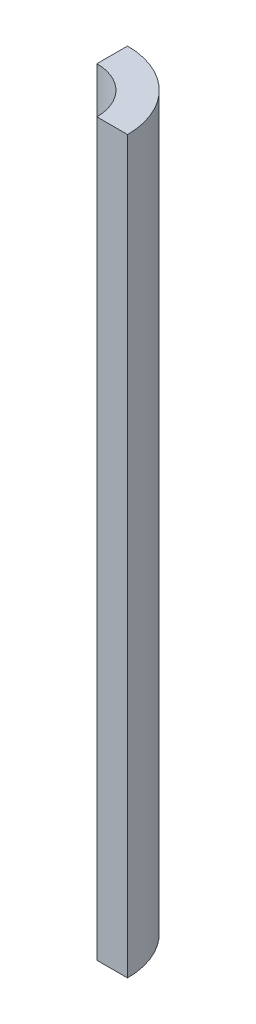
SolidWorks part; units mm, degrees
ref_plane "Front Plane" through (0, 0, 0) normal (0, 0, 1) x (1, 0, 0)
ref_plane "Top Plane" through (0, 0, 0) normal (0, 1, 0) x (1, 0, 0)
ref_plane "Right Plane" through (0, 0, 0) normal (1, 0, 0) x (0, 0, -1)
sketch "Sketch1" plane through (0, 0, 0) normal (0, 1, 0) x (1, 0, 0)
  line L0 (0, 3) -> (0, 5)
  line L1 (3, 0) -> (5, 0)
  line L2 (0, 0) -> (0, 3) construction
  line L3 (0, 0) -> (3, 0) construction
  arc A0 (3, 0) -> (0, 3) centre (0, 0) ccw
  arc A1 (5, 0) -> (0, 5) centre (0, 0) ccw
  point P6 (0, 0)
  point P7 (0.74, 0.506)
  point P8 (0, 0)
  point P9 (0, 0)
  point P11 (0, 0)
  point P12 (0, 0)
  point P14 (0, 0)
  dimension "D1" = 3
  dimension "D2" = 5
extrude "Boss-Extrude1" add sketch "Sketch1" along normal blind 47.625
